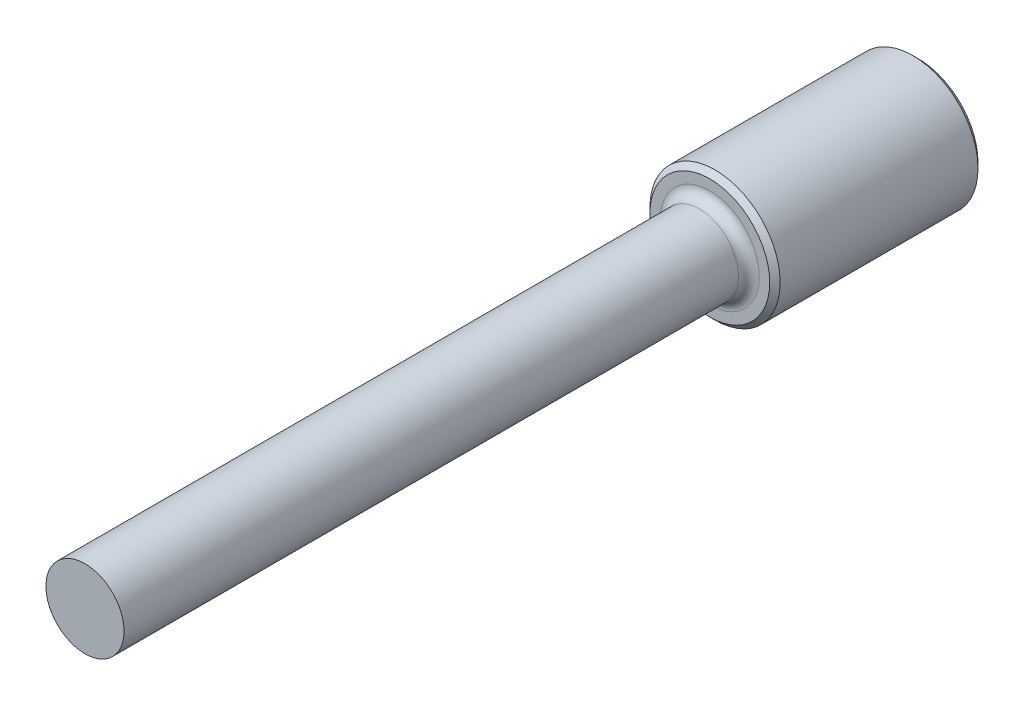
SolidWorks part; units mm, degrees
ref_plane "Plan de face" through (0, 0, 0) normal (0, 0, 1) x (1, 0, 0)
ref_plane "Plan de dessus" through (0, 0, 0) normal (0, 1, 0) x (1, 0, 0)
ref_plane "Plan de droite" through (0, 0, 0) normal (1, 0, 0) x (0, 0, -1)
sketch "Esquisse1" plane through (0, 0, 0) normal (0, 0, 1) x (1, 0, 0)
  circle A0 centre (0, 0) radius 2.5
  dimension "D1" = 5
extrude "Boss.-Extru.1" add sketch "Esquisse1" along normal blind 8
sketch "Esquisse2" plane through (0, 0, 8) normal (0, 0, 1) x (1, 0, 0)
  circle A0 centre (0, 0) radius 1.5
  dimension "D1" = 3
extrude "Boss.-Extru.2" add sketch "Esquisse2" along normal blind 24
hole_wizard "Trou taraudé M31" positions "Esquisse4" profile "Esquisse3" tap size "M3" standard "Iso"
sketch "Esquisse4" plane through (0, 0, 0) normal (0, 0, -1) x (-1, 0, 0)
  point P0 (0, 0)
sketch "Esquisse3" plane through (0, 0, 0) normal (1, 0, 0) x (0, 1, 0)
  line L0 (0, 0) -> (0, 8.2511)
  line L1 (0, 8.2511) -> (1.25, 7.5)
  line L2 (1.25, 7.5) -> (1.25, 0)
  line L5 (1.25, 0) -> (0, 0)
  line L10 (0, 8.2511) -> (-1.25, 7.5) construction
  line L11 (0, -6.35) -> (0, 107.95) construction
  dimension "Diamètre du trou pour taraudage" = 2.5
  dimension "Profondeur du trou pour taraudage" = 7.5
  dimension "Angle de pointe" = 118
chamfer "Chanfrein1" distance 0.2 angle 45 2 edges at (2.5, 0, 8) (2.5, 0, 0)
fillet "Congé1" radius 0.4 1 edges at (1.5, 0, 8)
